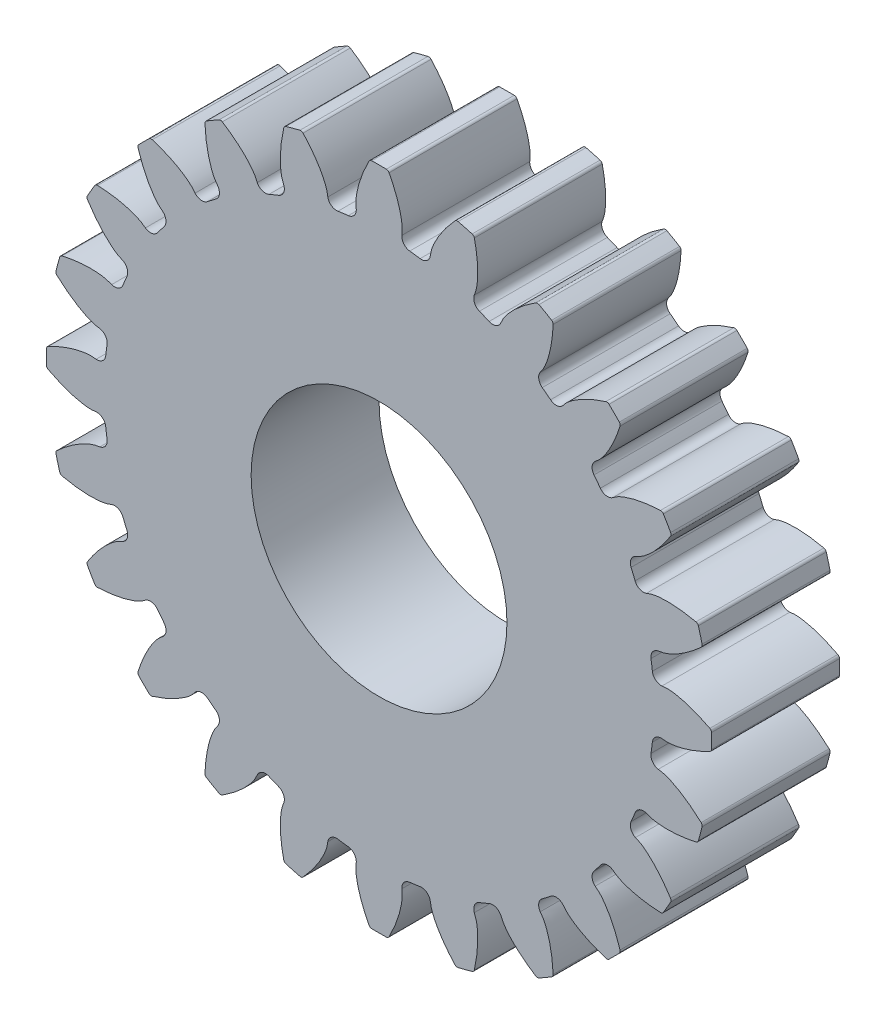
SolidWorks part; units mm, degrees
ref_plane "Front Plane" through (0, 0, 0) normal (0, 0, 1) x (1, 0, 0)
ref_plane "Top Plane" through (0, 0, 0) normal (0, 1, 0) x (1, 0, 0)
ref_plane "Right Plane" through (0, 0, 0) normal (1, 0, 0) x (0, 0, -1)
sketch "Sketch2" plane through (0, 0, 0) normal (0, 0, 1) x (1, 0, 0)
  line L0 (0, 0) -> (-0.9051, 11.2399) construction
  line L1 (0, 13) -> (0, 12) construction
  line L2 (0, 12) -> (0, 10.75) construction
  line L3 (-0.9051, 11.2399) -> (-0.9022, 11.3724) construction
  line L4 (-0.9022, 11.3724) -> (-0.8881, 11.5042) construction
  line L5 (-0.8881, 11.5042) -> (-0.8668, 11.635) construction
  line L6 (-0.8668, 11.635) -> (-0.8397, 11.7647) construction
  line L7 (-0.8397, 11.7647) -> (-0.8075, 11.8932) construction
  line L8 (-0.8075, 11.8932) -> (-0.771, 12.0206) construction
  line L9 (0.8225, 11.2463) -> (-0.9022, 11.3724) construction
  line L10 (1.5345, 11.1714) -> (-0.8881, 11.5042) construction
  line L11 (2.0768, 11.0834) -> (-0.8668, 11.635) construction
  line L12 (2.5301, 10.9888) -> (-0.8397, 11.7647) construction
  line L13 (2.9261, 10.8901) -> (-0.8075, 11.8932) construction
  line L14 (3.2807, 10.7885) -> (-0.771, 12.0206) construction
  line L15 (0, 0) -> (-0.5165, 7.8809) construction
  line L16 (-0.771, 12.0206) -> (-0.7306, 12.1468) construction
  line L17 (-0.7306, 12.1468) -> (-0.6864, 12.2718) construction
  line L18 (-0.6864, 12.2718) -> (-0.6389, 12.3955) construction
  line L19 (-0.6389, 12.3955) -> (-0.5883, 12.518) construction
  line L20 (-0.5883, 12.518) -> (-0.5347, 12.6391) construction
  line L21 (-0.5347, 12.6391) -> (-0.4783, 12.7591) construction
  line L22 (-0.4783, 12.7591) -> (-0.4193, 12.8777) construction
  line L23 (-0.4193, 12.8777) -> (-0.3577, 12.9951) construction
  line L24 (-0.7306, 12.1468) -> (3.6038, 10.6849) construction
  line L25 (-0.6864, 12.2718) -> (3.9016, 10.5798) construction
  line L26 (-0.6389, 12.3955) -> (4.1785, 10.4736) construction
  line L27 (-0.5883, 12.518) -> (4.4377, 10.3664) construction
  line L28 (-0.5347, 12.6391) -> (4.6817, 10.2585) construction
  line L29 (-0.4783, 12.7591) -> (4.9125, 10.15) construction
  line L30 (-0.4193, 12.8777) -> (5.1314, 10.0411) construction
  line L31 (-0.3577, 12.9951) -> (5.3398, 9.9319) construction
  line L32 (-18.8957, -50.1598) -> (17.326, 74.1084) construction
  line L33 (-0.9051, 11.2399) -> (-0.8945, 11.1078) construction
  line L34 (-0.8945, 11.1078) -> (-0.8839, 10.9757) construction
  line L35 (-0.8839, 10.9757) -> (-0.8732, 10.8437) construction
  line L36 (-0.8732, 10.8437) -> (-0.8626, 10.7116) construction
  line L37 (-0.8626, 10.7116) -> (-0.8519, 10.5795) construction
  line L38 (-0.8519, 10.5795) -> (-0.8413, 10.4474) construction
  arc A0 (-0.9051, 11.2399) -> (3.6038, 10.6849) centre (0, 0) cw construction
  arc A1 (3.9016, 10.5798) -> (-0.9051, 11.2399) centre (0, 0) ccw construction
  circle A2 centre (0, 0) radius 11.2763 construction
  circle A3 centre (0, 0) radius 10.75 construction
  arc A4 (-0.9051, 11.2399) -> (4.1785, 10.4736) centre (0, 0) cw construction
  arc A5 (-0.9051, 11.2399) -> (0.8225, 11.2463) centre (0, 0) cw construction
  arc A6 (1.5345, 11.1714) -> (-0.9051, 11.2399) centre (0, 0) ccw construction
  arc A7 (2.0768, 11.0834) -> (-0.9051, 11.2399) centre (0, 0) ccw construction
  arc A8 (2.5301, 10.9888) -> (-0.9051, 11.2399) centre (0, 0) ccw construction
  arc A9 (-0.9051, 11.2399) -> (2.9261, 10.8901) centre (0, 0) cw construction
  arc A10 (-0.9051, 11.2399) -> (3.2807, 10.7885) centre (0, 0) cw construction
  arc A11 (-0.9051, 11.2399) -> (4.4377, 10.3664) centre (0, 0) cw construction
  arc A12 (4.6817, 10.2585) -> (-0.9051, 11.2399) centre (0, 0) ccw construction
  arc A13 (4.9125, 10.15) -> (-0.9051, 11.2399) centre (0, 0) ccw construction
  arc A14 (-0.9051, 11.2399) -> (5.1314, 10.0411) centre (0, 0) cw construction
  arc A15 (-0.9051, 11.2399) -> (5.3398, 9.9319) centre (0, 0) cw construction
  circle A16 centre (0, 0) radius 12 construction
  circle A17 centre (0, 0) radius 13 construction
  arc A18 (-0.7848, 11.9743) -> (0.7848, 11.9743) centre (0, 0) cw construction
  arc A19 (0.3577, 12.9951) -> (-0.3577, 12.9951) centre (0, 0) ccw
  arc A20 (0.4526, 5.62) -> (-0.4526, 5.62) centre (0, 0) cw
  spline S0 degree 3 poles (-0.3577, 12.9951) (-0.3996, 12.9173) (-0.4599, 12.7993) (-0.5352, 12.6394) (-0.5888, 12.5182) (-0.6395, 12.3957) (-0.687, 12.272) (-0.7312, 12.147) (-0.7717, 12.0208) (-0.8083, 11.8934) (-0.8405, 11.7649) (-0.8678, 11.6352) (-0.8893, 11.5043) (-0.9039, 11.3726) (-0.9083, 11.2398) (-0.8936, 11.1079) (-0.8841, 10.9757) (-0.8732, 10.8437) (-0.8626, 10.7116) (-0.7221, 8.9703) (-0.59, 7.2729) (-0.4526, 5.62) knots 0 0 0 0 0.035369 0.053054 0.070739 0.088423 0.106108 0.123793 0.141477 0.159162 0.176847 0.194531 0.212216 0.2299 0.247585 0.26527 0.282954 0.300639 0.318324 0.336008 1 1 1 1
  spline S1 degree 3 poles (0.3577, 12.9951) (0.3996, 12.9173) (0.4599, 12.7993) (0.5352, 12.6394) (0.5888, 12.5182) (0.6395, 12.3957) (0.687, 12.272) (0.7312, 12.147) (0.7717, 12.0208) (0.8083, 11.8934) (0.8405, 11.7649) (0.8678, 11.6352) (0.8893, 11.5043) (0.9039, 11.3726) (0.9083, 11.2398) (0.8936, 11.1079) (0.8841, 10.9757) (0.8732, 10.8437) (0.8626, 10.7116) (0.7221, 8.9703) (0.59, 7.2729) (0.4526, 5.62) knots 0 0 0 0 0.035369 0.053054 0.070739 0.088423 0.106108 0.123793 0.141477 0.159162 0.176847 0.194531 0.212216 0.2299 0.247585 0.26527 0.282954 0.300639 0.318324 0.336008 1 1 1 1
  point P8 (-0.9051, 11.2399)
  point P44 (-0.7848, 11.9743)
  dimension "Pitch Dia" = 24
  dimension "Base Circle" = 22.5526
  dimension "Root_Diameter" = 21.5
  dimension "Outside_Diameter" = 26
  dimension "Addendum" = 1
  dimension "PressAngle_Measured" = 200
  dimension "Dedendum" = 1.25
  dimension "Tooth_Depth" = 2.25
  dimension "Tooth Width" = 1.5708
extrude "First Tooth" add sketch "Sketch2" along normal blind 5
ref_axis "Axis-Gear" through (0, 0, 5) along (0, 0, -1)
sketch "Sketch3" plane through (0, 0, 5) normal (0, 0, 1) x (1, 0, 0)
  circle A0 centre (0, 0) radius 10.75 construction
  circle A1 centre (0, 0) radius 10.75
extrude "Root Circle" add sketch "Sketch3" against normal up to surface (5 mm away)
fillet "Root Fillet" radius 0.35 2 edges at (0.8629, 10.7153, 2.5) (-0.8629, 10.7153, 2.5)
fillet "Tip Radius" radius 0.125 2 edges at (-0.3577, 12.9951, 2.5) (0.3577, 12.9951, 2.5)
pattern_circular "Teeth" count 24 over 360 about axis through (0, 0, 5) along (0, 0, -1) of "First Tooth", "Root Fillet", "Tip Radius"
sketch "Sketch4" plane through (0, 0, 5) normal (0, 0, 1) x (1, 0, 0)
  circle A0 centre (0, 0) radius 5
  dimension "D1" = 10
extrude "Center Hole" cut sketch "Sketch4" against normal up to next
